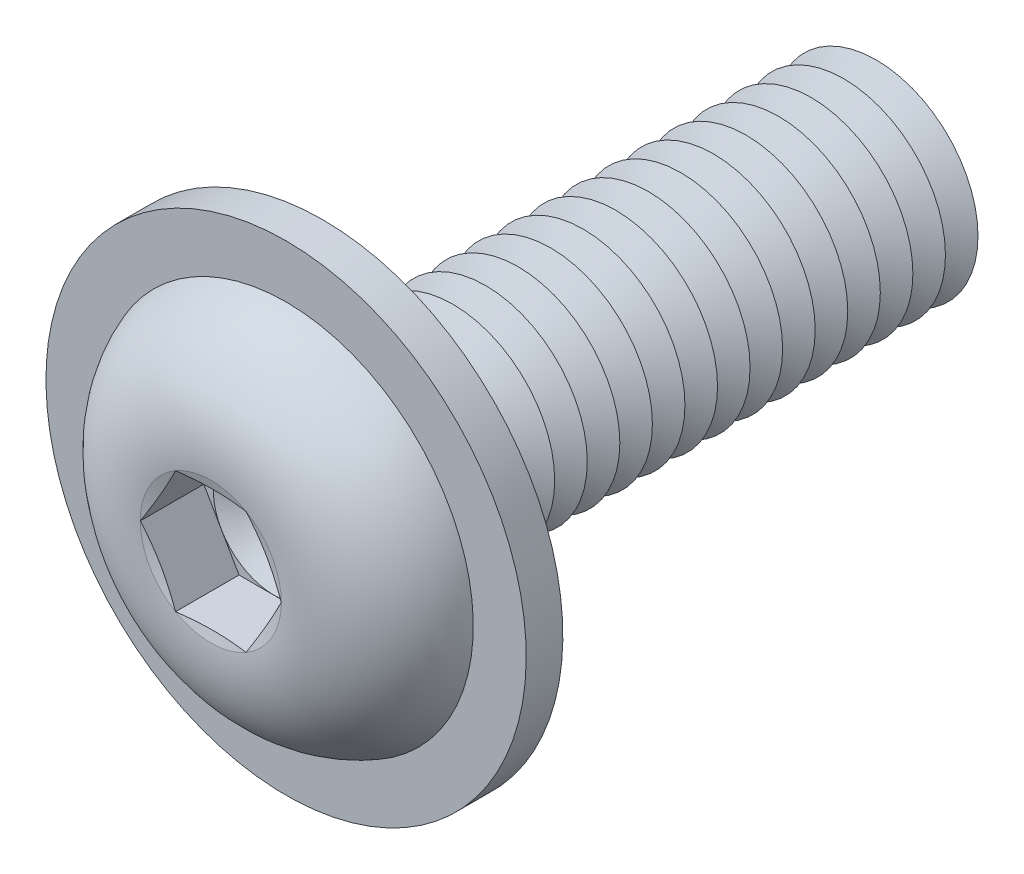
SolidWorks part; units mm, degrees
ref_plane "Front Plane" through (0, 0, 0) normal (0, 0, 1) x (1, 0, 0)
ref_plane "Top Plane" through (0, 0, 0) normal (0, 1, 0) x (1, 0, 0)
ref_plane "Right Plane" through (0, 0, 0) normal (1, 0, 0) x (0, 0, -1)
sketch "Sketch1" plane through (0, 0, 0) normal (1, 0, 0) x (0, 0, -1)
  line L0 (0, 2.5) -> (0, 4.75)
  line L3 (0, 2.5) -> (14, 2.5)
  line L4 (14, 2.5) -> (14, 0)
  line L5 (14, 0) -> (-2.75, 0) construction
  line L6 (-2.75, 0) -> (14, 0)
  line L7 (-2.75, 1.732) -> (-2.75, 0.866) construction
  line L8 (-2.75, 0.866) -> (-2.75, 0)
  line L9 (-2.75, 1.732) -> (-2.5179, 0.866)
  line L10 (-2.5179, 0.866) -> (-2.75, 0.866)
  line L11 (14, 0) -> (22.7481, 0) construction
  line L12 (0, 4.75) -> (-2.75, 4.75) construction
  arc A1 (0, 4.75) -> (-2.75, 1.732) centre (0, 1.9881) ccw
  point P8 (14, 1.25)
  dimension "D1" = 9.5
  dimension "D2" = 5
  dimension "D3" = 2.75
  dimension "D4" = 3.4641
  dimension "D5" = 14
  dimension "D6" = 15
revolve "Revolve1" add sketch "Sketch1" angle 360 about L5
fillet "Fillet1" radius 0.4 1 edges at (-2.5, 0, 0)
sketch "Sketch2" plane through (0, 0, 0) normal (1, 0, 0) x (0, 0, -1)
  line L0 (13.6, 2.5) -> (14.4, 2.5)
  line L1 (14, 2.5) -> (0.4, 2.5) construction
  line L2 (14.4, 2.5) -> (14, 1.8072)
  line L3 (14, -2.5) -> (14, 2.5) construction
  line L4 (14, 1.8072) -> (13.6, 2.5)
  dimension "D1" = 0.8
revolve "Cut-Revolve1" cut sketch "Sketch2" angle 360 about axis through (0, 0, -14) along (0, 0, -1)
pattern_linear "LPattern1" count 17 spacing 0.8 along (0, 0, 1) of "Cut-Revolve1"
sketch "Sketch3" plane through (0, 0, 2.75) normal (0, 0, 1) x (1, 0, 0)
  line L7 (0.866, 1.5) -> (-0.866, 1.5)
  line L8 (-0.866, 1.5) -> (-1.7321, 0)
  line L9 (-1.7321, 0) -> (-0.866, -1.5)
  line L10 (-0.866, -1.5) -> (0.866, -1.5)
  line L11 (0.866, -1.5) -> (1.732, 0)
  line L12 (1.732, 0) -> (0.866, 1.5)
  circle A0 centre (0, 0) radius 1.5 construction
  circle A3 centre (0, 0) radius 1.7321 construction
extrude "Cut-Extrude1" cut sketch "Sketch3" against normal blind 1.56
sketch "Sketch4" plane through (0, 0, 1.19) normal (0, 0, 1) x (1, 0, 0)
  line L1 (0.866, 1.5) -> (-0.866, 1.5) construction
  circle A0 centre (0, 0) radius 1.5
extrude "Cut-Extrude2" cut sketch "Sketch4" against normal through all draft 60
sketch "Sketch5" plane through (0, 0, 0) normal (0, 0, -1) x (-1, 0, 0)
  circle A0 centre (0, 0) radius 5.9
  circle A1 centre (0, 0) radius 2.9
  circle A2 centre (0, 0) radius 2.9 construction
  dimension "D1" = 11.8
extrude "Boss-Extrude1" add sketch "Sketch5" against normal blind 0.9
